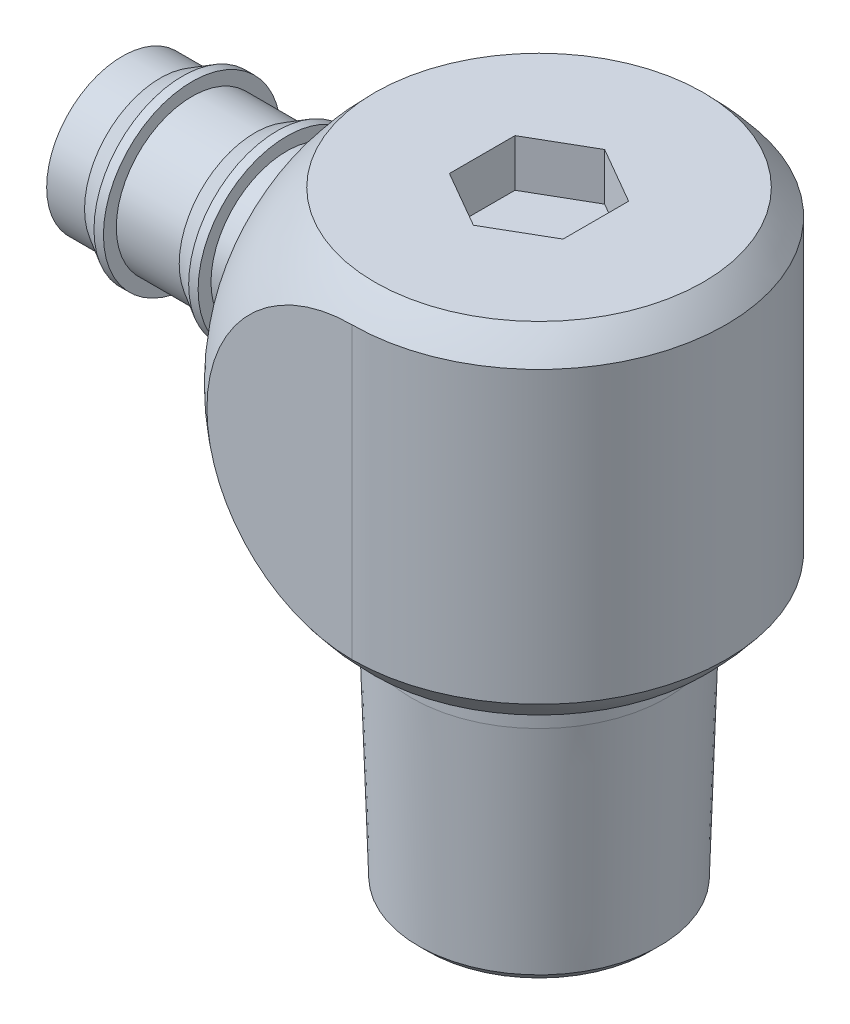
SolidWorks part; units mm, degrees
ref_plane "Front Plane" through (0, 0, 0) normal (0, 0, 1) x (1, 0, 0)
ref_plane "Top Plane" through (0, 0, 0) normal (0, 1, 0) x (1, 0, 0)
ref_plane "Right Plane" through (0, 0, 0) normal (1, 0, 0) x (0, 0, -1)
ref_plane "Plane1" through (0, 22.9489, 0) normal (0, 1, 0) x (-1, 0, 0)
sketch "Sketch1" plane through (0, 0, 0) normal (0, 0, 1) x (1, 0, 0)
  line L0 (0, 0) -> (0, 50000) construction
  line L1 (0, 42.7927) -> (0, 3.1051)
  line L2 (55, 22.9489) -> (-55, 22.9489) construction
  arc A1 (0, 3.1051) -> (0, 42.7927) centre (0, 22.9489) ccw
  dimension "D1" = 39.6875
revolve "Revolve1" add sketch "Sketch1" angle 360 about L0
sketch "Sketch3" plane through (0, 0, 0) normal (0, 1, 0) x (1, 0, 0)
  line L0 (2.5806, 0) -> (50002.5806, 0) construction
  line L1 (0, -15.6845) -> (-15.6845, -15.6845)
  line L2 (-15.6845, -15.6845) -> (-15.6845, 15.6845)
  line L3 (0, 15.6845) -> (-15.6845, 15.6845)
  circle A0 centre (0, 0) radius 15.6845 construction
  arc A1 (0, -15.6845) -> (0, 15.6845) centre (0, 0) ccw
  point P12 (-15.6845, 0)
  dimension "D1" = 31.369
extrude "Cut-Extrude1" cut sketch "Sketch3" against normal through all and the other way through all flip side to cut
sketch "Sketch4" plane through (0, 0, 0) normal (0, 0, 1) x (1, 0, 0)
  line L0 (0, 0) -> (0, 50000) construction
  line L1 (-25.4, 37.2364) -> (25.4, 37.2364)
  line L2 (-25.4, 37.2364) -> (-25.4, 8.6614)
  line L3 (-25.4, 8.6614) -> (25.4, 8.6614)
  line L4 (25.4, 37.2364) -> (25.4, 8.6614)
  line L5 (0, 10.7928) -> (0, 35.105) construction
  line L6 (0, 22.9489) -> (50000, 22.9489) construction
  line L7 (17.2529, 22.9489) -> (-17.2529, 22.9489) construction
  point P8 (0, 22.9489)
  dimension "D1" = 28.575
  dimension "D2" = 50.8
extrude "Cut-Extrude2" cut sketch "Sketch4" against normal through all and the other way through all flip side to cut
sketch "Sketch9" plane through (0, 22.9489, 0) normal (0, 1, 0) x (1, 0, 0)
  line L0 (0, 0) -> (50000, 0) construction
  line L1 (-34.925, 0) -> (-34.925, 6.35)
  line L2 (-34.925, 6.35) -> (-31.75, 6.35)
  line L3 (-31.75, 6.35) -> (-29.8803, 7.4295)
  line L4 (-29.8803, 7.4295) -> (-29.0865, 7.4295)
  line L5 (-29.0865, 7.4295) -> (-29.0865, 6.35)
  line L6 (-29.0865, 6.35) -> (-23.8125, 6.35)
  line L7 (-23.8125, 6.35) -> (-21.9428, 7.4295)
  line L8 (-21.9428, 7.4295) -> (-21.149, 7.4295)
  line L9 (-21.149, 7.4295) -> (-21.149, 6.35)
  line L10 (-21.149, 6.35) -> (0, 6.35)
  line L11 (0, 6.35) -> (0, 0)
  line L12 (-34.925, 0) -> (0, 0)
  line L13 (0, 0) -> (0, 50000) construction
  dimension "D1" = 12.7
  dimension "D2" = 1.0795
  dimension "D4" = 23.8125
  dimension "D5" = 3.175
  dimension "D6" = 34.925
  dimension "D7" = 0.7937
  dimension "D8" = 30
revolve "Revolve2" add sketch "Sketch9" angle 360 about L0
fillet "Fillet1" radius 1.1906 1 edges at (-15.6845, 22.9489, -6.35)
sketch "Sketch10" plane through (-34.925, 0, 0) normal (-1, 0, 0) x (0, 0, 1)
  circle A0 centre (0, 22.9489) radius 5.08
  circle A2 centre (0, 22.9489) radius 6.35 construction
  dimension "D1" = 1.27
extrude "Cut-Extrude3" cut sketch "Sketch10" against normal up to surface (34.925 mm away)
sketch "Sketch11" plane through (0, 0, 0) normal (0, 0, 1) x (1, 0, 0)
  line L0 (-13.771, 8.6614) -> (13.771, 8.6614) construction
  line L5 (0, 8.6614) -> (10.668, 8.6614)
  line L6 (10.668, 5.4864) -> (10.668, 8.6614)
  line L7 (10.0965, -12.8016) -> (10.668, 5.4864)
  line L8 (9.3345, -13.5636) -> (10.0965, -12.8016)
  line L9 (0, -13.5636) -> (9.3345, -13.5636)
  line L10 (0, -24.9401) -> (0, -50024.9401) construction
  line L11 (0, -13.5636) -> (0, 8.6614)
  dimension "D1" = 21.336
  dimension "D2" = 3.175
  dimension "D3" = 1.79
  dimension "D4" = 22.225
  dimension "D5" = 45
  dimension "D6" = 0.762
revolve "Revolve3" add sketch "Sketch11" angle 360 about L10
sketch "Sketch12" plane through (0, 37.2364, 0) normal (0, 1, 0) x (1, 0, 0)
  line L0 (0, -15.7163) -> (0, 15.7163) construction
  line L1 (0, -5.4993) -> (4.7625, -2.7496)
  line L2 (4.7625, -2.7496) -> (4.7625, 2.7496)
  line L3 (4.7625, 2.7496) -> (0, 5.4993)
  line L4 (0, 5.4993) -> (-4.7625, 2.7496)
  line L5 (-4.7625, 2.7496) -> (-4.7625, -2.7496)
  line L6 (-4.7625, -2.7496) -> (0, -5.4993)
  circle A0 centre (0, 0) radius 4.7625 construction
  circle A1 centre (0, 0) radius 9.3345 construction
  dimension "D1" = 9.525
extrude "Cut-Extrude4" cut sketch "Sketch12" against normal blind 3.9688
sketch "Sketch13" plane through (0, -13.5636, 0) normal (0, -1, 0) x (1, 0, 0)
  circle A1 centre (0, 0) radius 7.9375
  circle A2 centre (0, 0) radius 10.668 construction
  dimension "D1" = 15.875
extrude "Cut-Extrude5" cut sketch "Sketch13" against normal blind 44.7726
